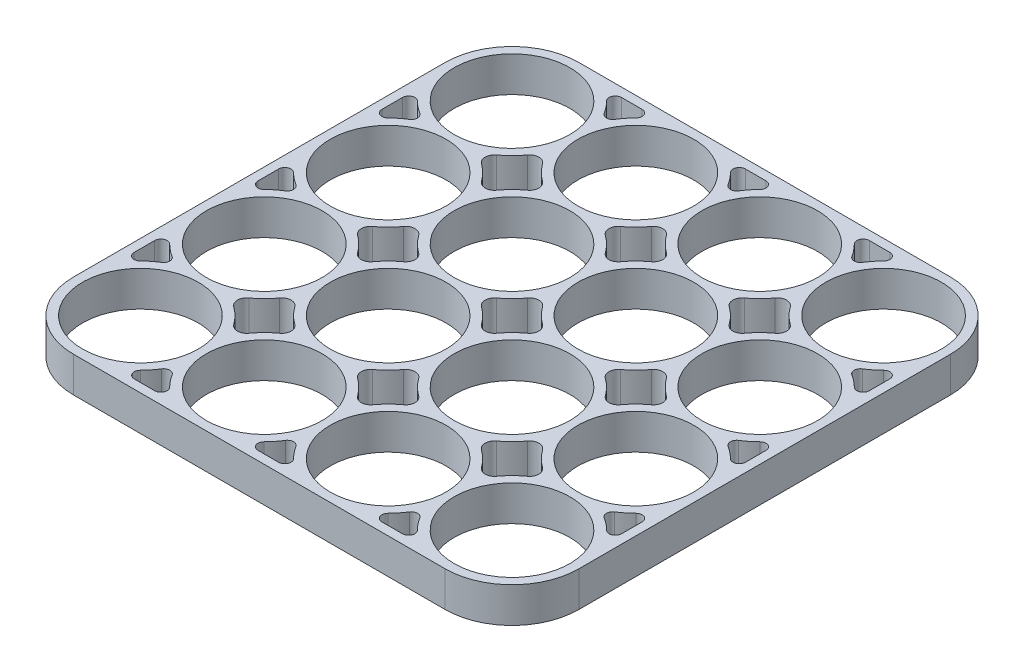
SolidWorks part; units mm, degrees
ref_plane "Ebene vorne" through (0, 0, 0) normal (0, 0, 1) x (1, 0, 0)
ref_plane "Ebene oben" through (0, 0, 0) normal (0, 1, 0) x (1, 0, 0)
ref_plane "Ebene rechts" through (0, 0, 0) normal (1, 0, 0) x (0, 0, -1)
sketch "Skizze1" plane through (0, 0, 0) normal (0, 1, 0) x (1, 0, 0)
  line L0 (-40.8, 30) -> (-40.8, -30)
  line L2 (-39.35, -21.6623) -> (-39.35, -18.3377)
  line L3 (-39.35, 18.3377) -> (-39.35, 21.6623)
  line L4 (-39.35, -1.6623) -> (-39.35, 1.6623)
  line L5 (-30, -40.8) -> (30, -40.8)
  line L7 (21.6623, -39.35) -> (18.3377, -39.35)
  line L8 (-18.3377, -39.35) -> (-21.6623, -39.35)
  line L9 (1.6623, -39.35) -> (-1.6623, -39.35)
  line L10 (40.8, 30) -> (40.8, -30)
  line L12 (39.35, -21.6623) -> (39.35, -18.3377)
  line L13 (39.35, 18.3377) -> (39.35, 21.6623)
  line L14 (39.35, -1.6623) -> (39.35, 1.6623)
  line L15 (-30, 40.8) -> (30, 40.8)
  line L16 (30, 40.8) -> (30, 39.35)
  line L17 (21.6623, 39.35) -> (18.3377, 39.35)
  line L18 (-18.3377, 39.35) -> (-21.6623, 39.35)
  line L19 (1.6623, 39.35) -> (-1.6623, 39.35)
  line L20 (0, -50) -> (0, 50) construction
  line L21 (-50, 0) -> (50, 0) construction
  circle A0 centre (-30, 30) radius 9.35
  circle A1 centre (-10, 30) radius 9.35
  circle A2 centre (10, 30) radius 9.35
  circle A3 centre (30, 30) radius 9.35
  circle A4 centre (-30, 10) radius 9.35
  circle A5 centre (-30, -10) radius 9.35
  circle A6 centre (-30, -30) radius 9.35
  circle A7 centre (-10, 10) radius 9.35
  circle A8 centre (10, 10) radius 9.35
  circle A9 centre (30, 10) radius 9.35
  circle A10 centre (-10, -10) radius 9.35
  circle A11 centre (10, -10) radius 9.35
  circle A12 centre (30, -10) radius 9.35
  circle A13 centre (-10, -30) radius 9.35
  circle A14 centre (10, -30) radius 9.35
  circle A15 centre (30, -30) radius 9.35
  arc A16 (-23.7117, 21.2195) -> (-21.2195, 23.7117) centre (-30, 30) ccw
  arc A17 (-3.7117, 21.2195) -> (-1.2195, 23.7117) centre (-10, 30) ccw
  arc A20 (21.2195, 3.7117) -> (23.7117, 1.2195) centre (30, 10) ccw
  arc A21 (18.7805, 16.2883) -> (16.2883, 18.7805) centre (10, 10) ccw
  arc A22 (-3.7117, 1.2195) -> (-1.2195, 3.7117) centre (-10, 10) ccw
  arc A24 (-23.7117, -18.7805) -> (-21.2195, -16.2883) centre (-30, -10) ccw
  arc A27 (23.7117, -1.2195) -> (21.2195, -3.7117) centre (30, -10) ccw
  arc A28 (23.7117, -21.2195) -> (21.2195, -23.7117) centre (30, -30) ccw
  arc A29 (18.7805, -23.7117) -> (16.2883, -21.2195) centre (10, -30) ccw
  arc A30 (-1.2195, -23.7117) -> (-3.7117, -21.2195) centre (-10, -30) ccw
  arc A31 (-21.2195, -23.7117) -> (-23.7117, -21.2195) centre (-30, -30) ccw
  arc A32 (35.7333, 0.8475) -> (37.6424, 2.3689) centre (30, 10) ccw
  arc A33 (35.7333, -19.1525) -> (37.6424, -17.6311) centre (30, -10) ccw
  arc A34 (20.8475, -35.7333) -> (22.3689, -37.6424) centre (30, -30) ccw
  arc A35 (0.8475, -35.7333) -> (2.3689, -37.6424) centre (10, -30) ccw
  arc A36 (-19.1525, -35.7333) -> (-17.6311, -37.6424) centre (-10, -30) ccw
  arc A37 (-35.7333, -20.8475) -> (-37.6424, -22.3689) centre (-30, -30) ccw
  arc A38 (-16.2883, -21.2195) -> (-18.7805, -23.7117) centre (-10, -30) ccw
  arc A39 (-3.7117, -18.7805) -> (-1.2195, -16.2883) centre (-10, -10) ccw
  arc A40 (3.7117, -21.2195) -> (1.2195, -23.7117) centre (10, -30) ccw
  arc A41 (16.2883, -18.7805) -> (18.7805, -16.2883) centre (10, -10) ccw
  arc A42 (21.2195, -16.2883) -> (23.7117, -18.7805) centre (30, -10) ccw
  arc A43 (18.7805, -3.7117) -> (16.2883, -1.2195) centre (10, -10) ccw
  arc A44 (1.2195, -16.2883) -> (3.7117, -18.7805) centre (10, -10) ccw
  arc A45 (-1.2195, -3.7117) -> (-3.7117, -1.2195) centre (-10, -10) ccw
  arc A46 (-18.7805, -16.2883) -> (-16.2883, -18.7805) centre (-10, -10) ccw
  arc A47 (-21.2195, -3.7117) -> (-23.7117, -1.2195) centre (-30, -10) ccw
  arc A48 (-16.2883, -1.2195) -> (-18.7805, -3.7117) centre (-10, -10) ccw
  arc A49 (-35.7333, -0.8475) -> (-37.6424, -2.3689) centre (-30, -10) ccw
  arc A50 (-23.7117, 1.2195) -> (-21.2195, 3.7117) centre (-30, 10) ccw
  arc A51 (-18.7805, 3.7117) -> (-16.2883, 1.2195) centre (-10, 10) ccw
  arc A52 (-21.2195, 16.2883) -> (-23.7117, 18.7805) centre (-30, 10) ccw
  arc A53 (3.7117, -1.2195) -> (1.2195, -3.7117) centre (10, -10) ccw
  arc A54 (16.2883, 1.2195) -> (18.7805, 3.7117) centre (10, 10) ccw
  arc A55 (-1.2195, 16.2883) -> (-3.7117, 18.7805) centre (-10, 10) ccw
  arc A56 (1.2195, 3.7117) -> (3.7117, 1.2195) centre (10, 10) ccw
  arc A57 (-35.7333, 19.1525) -> (-37.6424, 17.6311) centre (-30, 10) ccw
  arc A58 (-16.2883, 18.7805) -> (-18.7805, 16.2883) centre (-10, 10) ccw
  arc A59 (3.7117, 18.7805) -> (1.2195, 16.2883) centre (10, 10) ccw
  arc A60 (16.2883, 21.2195) -> (18.7805, 23.7117) centre (10, 30) ccw
  arc A61 (23.7117, 18.7805) -> (21.2195, 16.2883) centre (30, 10) ccw
  arc A62 (35.7333, 20.8475) -> (37.6424, 22.3689) centre (30, 30) ccw
  arc A63 (19.1525, 35.7333) -> (17.6311, 37.6424) centre (10, 30) ccw
  arc A64 (21.2195, 23.7117) -> (23.7117, 21.2195) centre (30, 30) ccw
  arc A65 (1.2195, 23.7117) -> (3.7117, 21.2195) centre (10, 30) ccw
  arc A66 (-0.8475, 35.7333) -> (-2.3689, 37.6424) centre (-10, 30) ccw
  arc A67 (-20.8475, 35.7333) -> (-22.3689, 37.6424) centre (-30, 30) ccw
  arc A68 (-18.7805, 23.7117) -> (-16.2883, 21.2195) centre (-10, 30) ccw
  arc A69 (-37.6424, 22.3689) -> (-35.7333, 20.8475) centre (-30, 30) ccw
  arc A70 (-37.6424, 2.3689) -> (-35.7333, 0.8475) centre (-30, 10) ccw
  arc A71 (-37.6424, -17.6311) -> (-35.7333, -19.1525) centre (-30, -10) ccw
  arc A72 (-40.8, -30) -> (-30, -40.8) centre (-30, -30) ccw
  arc A73 (-22.3689, -37.6424) -> (-20.8475, -35.7333) centre (-30, -30) ccw
  arc A74 (-2.3689, -37.6424) -> (-0.8475, -35.7333) centre (-10, -30) ccw
  arc A75 (17.6311, -37.6424) -> (19.1525, -35.7333) centre (10, -30) ccw
  arc A76 (30, -40.8) -> (40.8, -30) centre (30, -30) ccw
  arc A77 (40.8, 30) -> (30, 40.8) centre (30, 30) ccw
  arc A78 (37.6424, 17.6311) -> (35.7333, 19.1525) centre (30, 10) ccw
  arc A79 (37.6424, -2.3689) -> (35.7333, -0.8475) centre (30, -10) ccw
  arc A80 (37.6424, -22.3689) -> (35.7333, -20.8475) centre (30, -30) ccw
  arc A81 (-30, 40.8) -> (-40.8, 30) centre (-30, 30) ccw
  arc A82 (-17.6311, 37.6424) -> (-19.1525, 35.7333) centre (-10, 30) ccw
  arc A83 (2.3689, 37.6424) -> (0.8475, 35.7333) centre (10, 30) ccw
  arc A84 (22.3689, 37.6424) -> (20.8475, 35.7333) centre (30, 30) ccw
  arc A85 (-37.6424, 17.6311) -> (-39.35, 18.3377) centre (-38.35, 18.3377) cw
  arc A86 (-35.7333, 19.1525) -> (-35.7333, 20.8475) centre (-36.2642, 20) ccw
  arc A87 (-37.6424, 22.3689) -> (-39.35, 21.6623) centre (-38.35, 21.6623) ccw
  arc A88 (-37.6424, -2.3689) -> (-39.35, -1.6623) centre (-38.35, -1.6623) cw
  arc A89 (-35.7333, -0.8475) -> (-35.7333, 0.8475) centre (-36.2642, 0) ccw
  arc A90 (-37.6424, 2.3689) -> (-39.35, 1.6623) centre (-38.35, 1.6623) ccw
  arc A91 (-37.6424, -22.3689) -> (-39.35, -21.6623) centre (-38.35, -21.6623) cw
  arc A92 (-35.7333, -20.8475) -> (-35.7333, -19.1525) centre (-36.2642, -20) ccw
  arc A93 (-37.6424, -17.6311) -> (-39.35, -18.3377) centre (-38.35, -18.3377) ccw
  arc A94 (-21.6623, -39.35) -> (-22.3689, -37.6424) centre (-21.6623, -38.35) cw
  arc A95 (-18.3377, -39.35) -> (-17.6311, -37.6424) centre (-18.3377, -38.35) ccw
  arc A96 (-19.1525, -35.7333) -> (-20.8475, -35.7333) centre (-20, -36.2642) ccw
  arc A97 (-1.6623, -39.35) -> (-2.3689, -37.6424) centre (-1.6623, -38.35) cw
  arc A98 (1.6623, -39.35) -> (2.3689, -37.6424) centre (1.6623, -38.35) ccw
  arc A99 (0.8475, -35.7333) -> (-0.8475, -35.7333) centre (0, -36.2642) ccw
  arc A100 (18.3377, -39.35) -> (17.6311, -37.6424) centre (18.3377, -38.35) cw
  arc A101 (21.6623, -39.35) -> (22.3689, -37.6424) centre (21.6623, -38.35) ccw
  arc A102 (20.8475, -35.7333) -> (19.1525, -35.7333) centre (20, -36.2642) ccw
  arc A103 (35.7333, -20.8475) -> (35.7333, -19.1525) centre (36.2642, -20) cw
  arc A104 (37.6424, -22.3689) -> (39.35, -21.6623) centre (38.35, -21.6623) ccw
  arc A105 (39.35, -18.3377) -> (37.6424, -17.6311) centre (38.35, -18.3377) ccw
  arc A106 (35.7333, -0.8475) -> (35.7333, 0.8475) centre (36.2642, 0) cw
  arc A107 (39.35, -1.6623) -> (37.6424, -2.3689) centre (38.35, -1.6623) cw
  arc A108 (39.35, 1.6623) -> (37.6424, 2.3689) centre (38.35, 1.6623) ccw
  arc A109 (39.35, 21.6623) -> (37.6424, 22.3689) centre (38.35, 21.6623) ccw
  arc A110 (37.6424, 17.6311) -> (39.35, 18.3377) centre (38.35, 18.3377) ccw
  arc A111 (35.7333, 19.1525) -> (35.7333, 20.8475) centre (36.2642, 20) cw
  arc A112 (19.1525, 35.7333) -> (20.8475, 35.7333) centre (20, 36.2642) ccw
  arc A113 (22.3689, 37.6424) -> (21.6623, 39.35) centre (21.6623, 38.35) ccw
  arc A114 (17.6311, 37.6424) -> (18.3377, 39.35) centre (18.3377, 38.35) cw
  arc A115 (-0.8475, 35.7333) -> (0.8475, 35.7333) centre (0, 36.2642) ccw
  arc A116 (2.3689, 37.6424) -> (1.6623, 39.35) centre (1.6623, 38.35) ccw
  arc A117 (-2.3689, 37.6424) -> (-1.6623, 39.35) centre (-1.6623, 38.35) cw
  arc A118 (-20.8475, 35.7333) -> (-19.1525, 35.7333) centre (-20, 36.2642) ccw
  arc A119 (-17.6311, 37.6424) -> (-18.3377, 39.35) centre (-18.3377, 38.35) ccw
  arc A120 (-21.6623, 39.35) -> (-22.3689, 37.6424) centre (-21.6623, 38.35) ccw
  arc A121 (-3.7117, -1.2195) -> (-3.7117, 1.2195) centre (-2.8383, 0) cw
  arc A122 (3.7117, -1.2195) -> (3.7117, 1.2195) centre (2.8383, 0) ccw
  arc A123 (1.2195, -3.7117) -> (-1.2195, -3.7117) centre (0, -2.8383) cw
  arc A124 (1.2195, 3.7117) -> (-1.2195, 3.7117) centre (0, 2.8383) ccw
  arc A125 (-16.2883, -1.2195) -> (-16.2883, 1.2195) centre (-17.1617, 0) ccw
  arc A126 (-18.7805, -3.7117) -> (-21.2195, -3.7117) centre (-20, -2.8383) cw
  arc A127 (-23.7117, -1.2195) -> (-23.7117, 1.2195) centre (-22.8383, 0) cw
  arc A128 (-21.2195, 3.7117) -> (-18.7805, 3.7117) centre (-20, 2.8383) cw
  arc A129 (18.7805, -3.7117) -> (21.2195, -3.7117) centre (20, -2.8383) ccw
  arc A130 (16.2883, -1.2195) -> (16.2883, 1.2195) centre (17.1617, 0) cw
  arc A131 (23.7117, -1.2195) -> (23.7117, 1.2195) centre (22.8383, 0) ccw
  arc A132 (21.2195, 3.7117) -> (18.7805, 3.7117) centre (20, 2.8383) ccw
  arc A133 (18.7805, -23.7117) -> (21.2195, -23.7117) centre (20, -22.8383) ccw
  arc A134 (23.7117, -21.2195) -> (23.7117, -18.7805) centre (22.8383, -20) ccw
  arc A135 (16.2883, -21.2195) -> (16.2883, -18.7805) centre (17.1617, -20) cw
  arc A136 (21.2195, -16.2883) -> (18.7805, -16.2883) centre (20, -17.1617) ccw
  arc A137 (1.2195, -23.7117) -> (-1.2195, -23.7117) centre (0, -22.8383) cw
  arc A138 (3.7117, -21.2195) -> (3.7117, -18.7805) centre (2.8383, -20) ccw
  arc A139 (-3.7117, -21.2195) -> (-3.7117, -18.7805) centre (-2.8383, -20) cw
  arc A140 (1.2195, -16.2883) -> (-1.2195, -16.2883) centre (0, -17.1617) ccw
  arc A141 (-21.2195, -23.7117) -> (-18.7805, -23.7117) centre (-20, -22.8383) ccw
  arc A142 (-16.2883, -21.2195) -> (-16.2883, -18.7805) centre (-17.1617, -20) ccw
  arc A143 (-21.2195, -16.2883) -> (-18.7805, -16.2883) centre (-20, -17.1617) cw
  arc A144 (-23.7117, -21.2195) -> (-23.7117, -18.7805) centre (-22.8383, -20) cw
  arc A145 (-16.2883, 18.7805) -> (-16.2883, 21.2195) centre (-17.1617, 20) ccw
  arc A146 (-23.7117, 18.7805) -> (-23.7117, 21.2195) centre (-22.8383, 20) cw
  arc A147 (-18.7805, 16.2883) -> (-21.2195, 16.2883) centre (-20, 17.1617) cw
  arc A148 (1.2195, 16.2883) -> (-1.2195, 16.2883) centre (0, 17.1617) cw
  arc A149 (-3.7117, 18.7805) -> (-3.7117, 21.2195) centre (-2.8383, 20) cw
  arc A150 (16.2883, 18.7805) -> (16.2883, 21.2195) centre (17.1617, 20) cw
  arc A151 (23.7117, 18.7805) -> (23.7117, 21.2195) centre (22.8383, 20) ccw
  arc A152 (21.2195, 16.2883) -> (18.7805, 16.2883) centre (20, 17.1617) cw
  arc A153 (21.2195, 23.7117) -> (18.7805, 23.7117) centre (20, 22.8383) ccw
  arc A154 (3.7117, 18.7805) -> (3.7117, 21.2195) centre (2.8383, 20) ccw
  arc A155 (1.2195, 23.7117) -> (-1.2195, 23.7117) centre (0, 22.8383) ccw
  arc A156 (-18.7805, 23.7117) -> (-21.2195, 23.7117) centre (-20, 22.8383) ccw
  point P115 (-39.35, 15.4053)
  point P120 (-39.35, 24.5947)
  point P123 (-39.35, -4.5947)
  point P136 (-24.5947, -39.35)
  point P155 (34.0792, -20)
  point P158 (39.35, -24.5947)
  point P165 (39.35, -4.5947)
  point P172 (39.35, 15.4053)
  point P185 (4.5947, 39.35)
  point P192 (-15.4053, 39.35)
  point P199 (0, 40.8)
  point P220 (20, -5.9208)
  point P225 (25.9208, 0)
  dimension "D1" = 18.7
  dimension "D2" = 21.6
  dimension "D9" = 1
  dimension "D10" = 1.5
  dimension "D12" = 1.45
  dimension "D13" = 10.8
  dimension "D3" = 20
  dimension "D4" = 20
  dimension "D5" = 20
  dimension "D6" = 20
  dimension "D7" = 20
  dimension "D8" = 20
extrude "Aufsatz-Linear austragen1" add sketch "Skizze1" along normal blind 5.7
